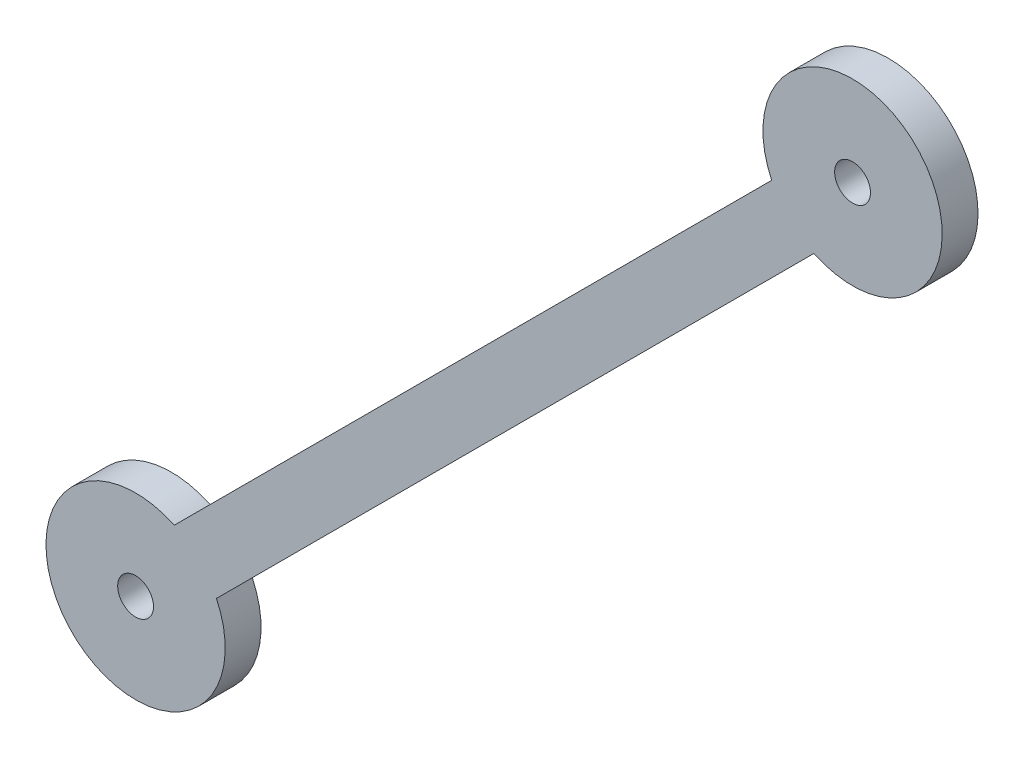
SolidWorks part; units mm, degrees
ref_plane "Plan de face" through (0, 0, 0) normal (0, 0, 1) x (1, 0, 0)
ref_plane "Plan de dessus" through (0, 0, 0) normal (0, 1, 0) x (1, 0, 0)
ref_plane "Plan de droite" through (0, 0, 0) normal (1, 0, 0) x (0, 0, -1)
sketch "Esquisse1" plane through (0, 0, 0) normal (0, 0, 1) x (1, 0, 0)
  line L0 (-31.8773, 0) -> (31.8773, 0) construction
  line L2 (0, 31.8773) -> (0, -30.6288) construction
  line L3 (0, 0) -> (120, 120) construction
  line L4 (6.4645, 13.5355) -> (106.4645, 113.5355)
  line L5 (0, 0) -> (120, 0) construction
  line L6 (0, 0) -> (0, 120) construction
  line L7 (0, 120) -> (120, 120) construction
  line L8 (120, 0) -> (120, 120) construction
  line L9 (113.5355, 106.4645) -> (13.5355, 6.4645)
  circle A0 centre (0, 0) radius 3
  arc A1 (6.4645, 13.5355) -> (13.5355, 6.4645) centre (0, 0) ccw
  circle A2 centre (120, 120) radius 3
  arc A3 (113.5355, 106.4645) -> (106.4645, 113.5355) centre (120, 120) ccw
  dimension "D1" = 5
extrude "Extrusion1" add sketch "Esquisse1" along normal blind 6
